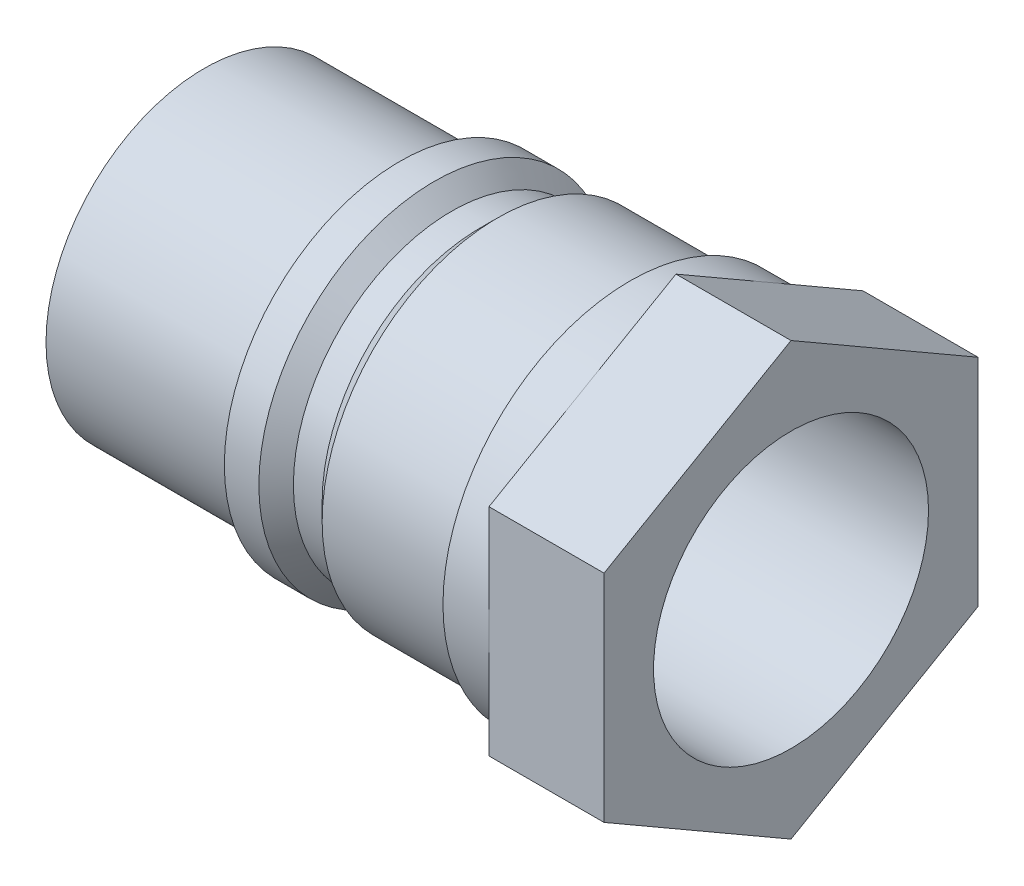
SolidWorks part; units mm, degrees
ref_plane "Alzado" through (0, 0, 0) normal (0, 0, 1) x (1, 0, 0)
ref_plane "Planta" through (0, 0, 0) normal (0, 1, 0) x (1, 0, 0)
ref_plane "Vista lateral" through (0, 0, 0) normal (1, 0, 0) x (0, 0, -1)
sketch "Croquis1" plane through (0, 0, 0) normal (0, 0, 1) x (1, 0, 0)
  line L0 (0, 0) -> (82, 0) construction
  line L1 (0, 0) -> (0, 27.5)
  line L2 (0, 27.5) -> (34, 27.5)
  line L3 (34, 27.5) -> (34, 30.5)
  line L4 (34, 30.5) -> (40, 30.5)
  line L5 (40, 30.5) -> (43, 27.5)
  line L6 (43, 27.5) -> (48, 27.5)
  line L7 (48, 27.5) -> (51, 30.5)
  line L8 (51, 30.5) -> (74, 30.5)
  line L9 (74, 30.5) -> (74, 32.5)
  line L10 (74, 32.5) -> (82, 32.5)
  line L11 (82, 32.5) -> (82, 0)
  line L12 (0, 0) -> (82, 0)
  dimension "D1" = 55
  dimension "D2" = 82
  dimension "D3" = 8
  dimension "D4" = 2
  dimension "D5" = 34
  dimension "D6" = 6
  dimension "D7" = 3
  dimension "D8" = 5
  dimension "D9" = 225
revolve "Revolución1" add sketch "Croquis1" angle 360 about L0
sketch "Croquis2" plane through (82, 0, 0) normal (1, 0, 0) x (0, 0, -1)
  line L1 (0, 37.5278) -> (-32.5, 18.7639)
  line L2 (-32.5, 18.7639) -> (-32.5, -18.7639)
  line L3 (-32.5, -18.7639) -> (0, -37.5278)
  line L4 (0, -37.5278) -> (32.5, -18.7639)
  line L5 (32.5, -18.7639) -> (32.5, 18.7639)
  line L6 (32.5, 18.7639) -> (0, 37.5278)
  circle A0 centre (0, 0) radius 32.5 construction
  dimension "D1" = 65
extrude "Saliente-Extruir1" add sketch "Croquis2" along normal blind 20
sketch "Croquis3" plane through (102, 0, 0) normal (1, 0, 0) x (0, 0, -1)
  circle A0 centre (0, 0) radius 23.9
  dimension "D1" = 47.8
extrude "Cortar-Extruir1" cut sketch "Croquis3" against normal through all
